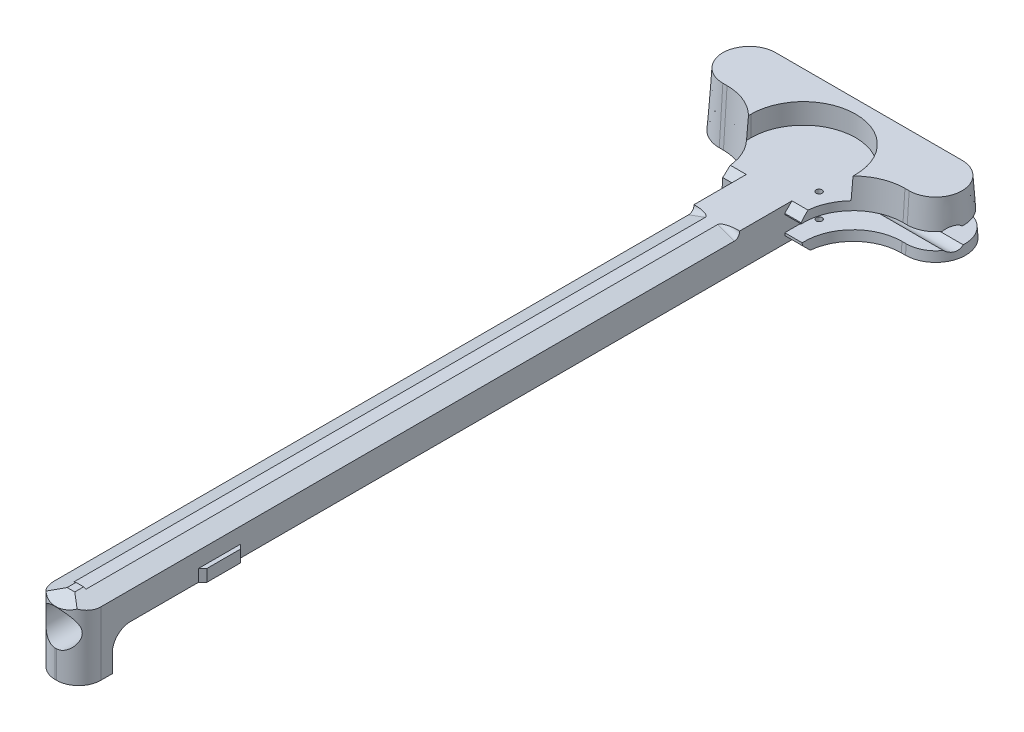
SolidWorks part; units mm, degrees
ref_plane "Front Plane" through (0, 0, 0) normal (0, 0, 1) x (1, 0, 0)
ref_plane "Top Plane" through (0, 0, 0) normal (0, 1, 0) x (1, 0, 0)
ref_plane "Right Plane" through (0, 0, 0) normal (1, 0, 0) x (0, 0, -1)
imported_body "CHARGEING HANDLE"
sketch "Sketch1" plane through (0, 1.3388, -20.103) normal (0, 0.0664, -0.9978) x (-1, 0, 0)
  line L1 (-15.0364, 8.8853) -> (16.6446, 8.8853)
  line L2 (-15.0364, 8.8853) -> (-15.0364, 4.4482)
  line L3 (-15.0364, 4.4482) -> (16.6446, 4.4482)
  line L4 (16.6446, 8.8853) -> (16.6446, 4.4482)
extrude "Boss-Extrude1" add sketch "Sketch1" against normal blind 2.54
